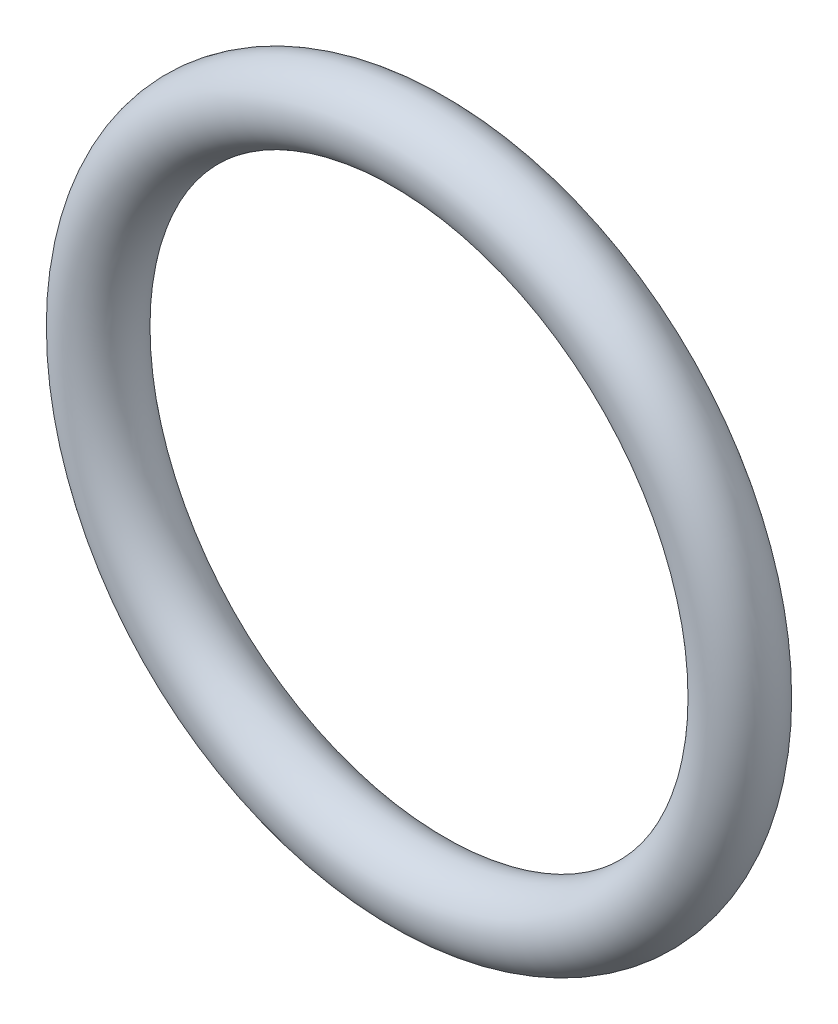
SolidWorks part; units mm, degrees
ref_plane "Face" through (0, 0, 0) normal (0, 0, 1) x (1, 0, 0)
ref_plane "Dessus" through (0, 0, 0) normal (0, 1, 0) x (1, 0, 0)
ref_plane "Droite" through (0, 0, 0) normal (1, 0, 0) x (0, 0, -1)
sketch "Esquisse2" plane through (0, 0, 0) normal (0, -1, 0) x (1, 0, 0)
  line L0 (0, 1.9163) -> (0, -48.493) construction
  line L1 (0, -189) -> (0, 0) construction
  line L2 (7.75, 1.5) -> (7.75, 4) construction
  line L3 (-9.75, 4) -> (9.75, 4) construction
  circle A0 centre (8.75, 2.75) radius 1
  dimension "D1" = 2
  dimension "D2" = 1.25
revolve "Base-Révolution" add sketch "Esquisse2" angle 360 about L0
